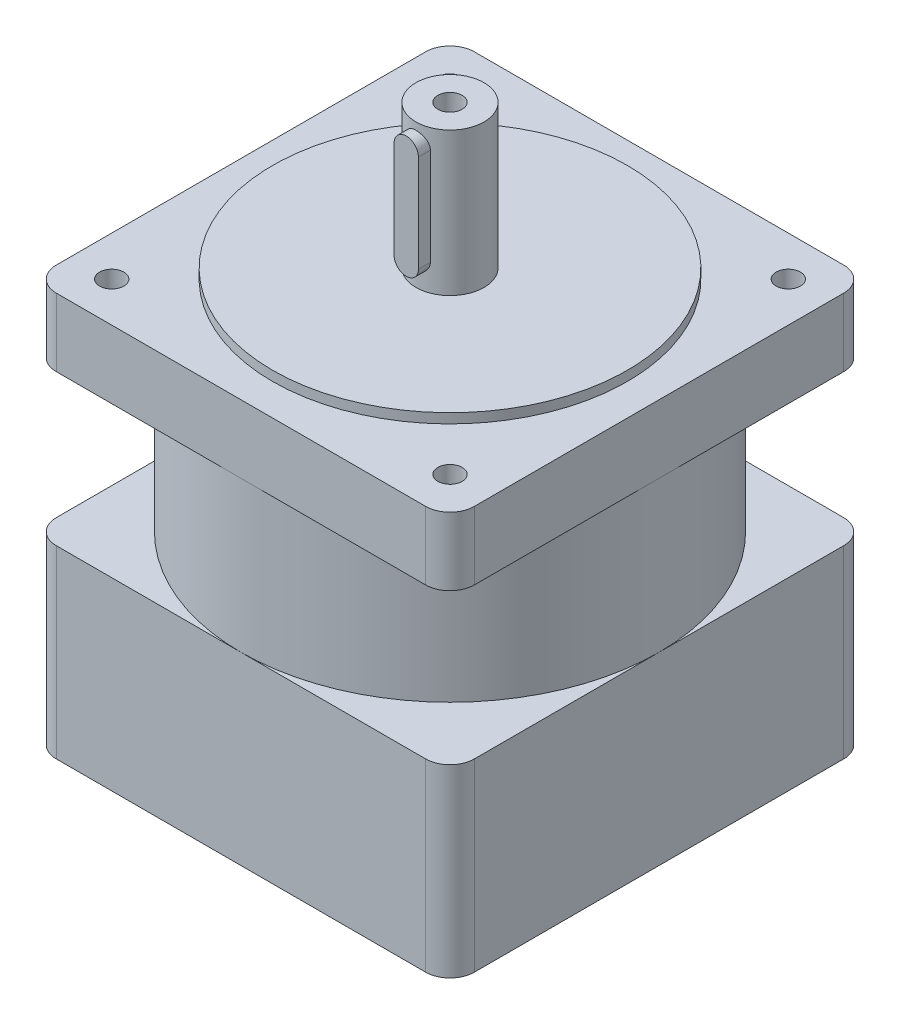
SolidWorks part; units mm, degrees
ref_plane "前视" through (0, 0, 0) normal (0, 0, 1) x (1, 0, 0)
ref_plane "上视" through (0, 0, 0) normal (0, 1, 0) x (1, 0, 0)
ref_plane "右视" through (0, 0, 0) normal (1, 0, 0) x (0, 0, -1)
sketch "草图1" plane through (0, 0, 0) normal (0, 1, 0) x (1, 0, 0)
  line L1 (-43, 43) -> (43, 43)
  line L2 (-43, 43) -> (-43, -43)
  line L3 (-43, -43) -> (43, -43)
  line L4 (43, 43) -> (43, -43)
  line L5 (-43, 43) -> (43, -43) construction
  line L6 (-43, -43) -> (43, 43) construction
  point P0 (0, 0)
extrude "凸台-拉伸1" add sketch "草图1" along normal blind 14
fillet "圆角1" radius 5 4 edges at (-43, 7, -43) (43, 7, -43) (43, 7, 43) (-43, 7, 43)
ref_plane "基准面1" through (0, 14, 0) normal (0, 1, 0) x (1, 0, 0)
sketch "草图2" plane through (0, 14, 0) normal (0, 1, 0) x (1, 0, 0)
  circle A0 centre (0, 0) radius 36.5
  dimension "D1" = 73
extrude "凸台-拉伸2" add sketch "草图2" along normal blind 2
sketch "草图3" plane through (0, 14, 0) normal (0, 1, 0) x (1, 0, 0)
  circle A0 centre (0, 0) radius 7
  dimension "D1" = 14
extrude "凸台-拉伸3" add sketch "草图3" along normal blind 31.5
ref_plane "基准面2" through (0, 0, 4) normal (0, 0, 1) x (1, 0, 0)
sketch "草图4" plane through (0, 0, 4) normal (0, 0, 1) x (1, 0, 0)
  line L2 (-2.5, 41.5) -> (-2.5, 21.5)
  line L4 (2.5, 41.5) -> (2.5, 21.5)
  arc A0 (-2.5, 41.5) -> (2.5, 41.5) centre (0, 41.5) cw
  arc A1 (-2.5, 21.5) -> (2.5, 21.5) centre (0, 21.5) ccw
  dimension "D1" = 2.5
  dimension "D2" = 2.5
extrude "凸台-拉伸4" add sketch "草图4" along normal blind 5
ref_plane "基准面3" through (0, 45.5, 0) normal (0, 1, 0) x (1, 0, 0)
hole_wizard "M6 螺纹孔1" positions "草图6" profile "草图5" tap size "M6" standard "ISO"
sketch "草图6" plane through (0, 45.5, 0) normal (0, 1, 0) x (1, 0, 0)
  point P0 (0, 0)
sketch "草图5" plane through (0, 45.5, 0) normal (1, 0, 0) x (0, 0, 1)
  line L0 (0, 0) -> (0, 18.5022)
  line L1 (0, 18.5022) -> (2.5, 17)
  line L2 (2.5, 17) -> (2.5, 0)
  line L5 (2.5, 0) -> (0, 0)
  line L10 (0, 18.5022) -> (-2.5, 17) construction
  line L11 (0, -6.35) -> (0, 107.95) construction
  dimension "螺纹孔钻头直径" = 5
  dimension "螺纹孔钻头深度" = 17
  dimension "导头角度" = 118
sketch "草图7" plane through (0, 0, 0) normal (0, 1, 0) x (1, 0, 0)
  circle A0 centre (0, 0) radius 43
  dimension "D1" = 86
extrude "凸台-拉伸5" add sketch "草图7" against normal blind 31
ref_plane "基准面4" through (0, -31, 0) normal (0, -1, 0) x (-1, 0, 0)
sketch "草图8" plane through (0, -31, 0) normal (0, -1, 0) x (-1, 0, 0)
  line L1 (43, -43) -> (-43, -43)
  line L2 (43, -43) -> (43, 43)
  line L3 (43, 43) -> (-43, 43)
  line L4 (-43, -43) -> (-43, 43)
  line L5 (43, -43) -> (-43, 43) construction
  line L6 (43, 43) -> (-43, -43) construction
  point P0 (0, 0)
extrude "凸台-拉伸6" add sketch "草图8" along normal blind 38
fillet "圆角2" radius 5 4 edges at (-43, -50, -43) (43, -50, -43) (43, -50, 43) (-43, -50, 43)
ref_plane "基准面5" through (0, -69, 0) normal (0, -1, 0) x (-1, 0, 0)
sketch "草图9" plane through (0, -69, 0) normal (0, -1, 0) x (-1, 0, 0)
  circle A0 centre (0, 0) radius 36.5
  dimension "D1" = 73
extrude "切除-拉伸1" cut sketch "草图9" against normal blind 5
sketch "草图10" plane through (0, -69, 0) normal (0, -1, 0) x (-1, 0, 0)
  line L0 (2.5, -9) -> (2.5, -6.5383)
  line L2 (-2.5, -9) -> (2.5, -9)
  line L3 (-2.5, -9) -> (-2.5, -6.5383)
  arc A0 (-2.5, -6.5383) -> (2.5, -6.5383) centre (0, 0) cw
  dimension "D1" = 7
extrude "切除-拉伸3" cut sketch "草图10" against normal blind 34
sketch "草图11" plane through (0, -69, 0) normal (0, -1, 0) x (-1, 0, 0)
  line L1 (34.8, -34.8) -> (-34.8, -34.8)
  line L2 (34.8, -34.8) -> (34.8, 34.8)
  line L3 (34.8, 34.8) -> (-34.8, 34.8)
  line L4 (-34.8, -34.8) -> (-34.8, 34.8)
  line L5 (34.8, -34.8) -> (-34.8, 34.8) construction
  line L6 (34.8, 34.8) -> (-34.8, -34.8) construction
  point P0 (0, 0)
hole_wizard "M6 螺纹孔2" positions "草图13" profile "草图12" tap size "M6" standard "ISO"
sketch "草图13" plane through (0, -69, 0) normal (0, -1, 0) x (-1, 0, 0)
  point P0 (34.8, -34.8)
  point P3 (34.8, 34.8)
  point P6 (-34.8, 34.8)
  point P9 (-34.8, -34.8)
sketch "草图12" plane through (-34.8, -69, 34.8) normal (1, 0, 0) x (0, 0, -1)
  line L0 (0, 0) -> (0, 18.5022)
  line L1 (0, 18.5022) -> (2.5, 17)
  line L2 (2.5, 17) -> (2.5, 0)
  line L5 (2.5, 0) -> (0, 0)
  line L10 (0, 18.5022) -> (-2.5, 17) construction
  line L11 (0, -6.35) -> (0, 107.95) construction
  dimension "螺纹孔钻头直径" = 5
  dimension "螺纹孔钻头深度" = 17
  dimension "导头角度" = 118
hole_wizard "M6 螺纹孔3" positions "草图16" profile "草图15" tap size "M6" standard "ISO"
sketch "草图16" plane through (0, 14, 0) normal (0, 1, 0) x (1, 0, 0)
  point P0 (-34.8, 34.8)
  point P3 (-34.8, -34.8)
  point P6 (34.8, -34.8)
  point P9 (34.8, 34.8)
sketch "草图15" plane through (-34.8, 14, -34.8) normal (1, 0, 0) x (0, 0, 1)
  line L0 (0, 0) -> (0, 20.5022)
  line L1 (0, 20.5022) -> (2.5, 19)
  line L2 (2.5, 19) -> (2.5, 0)
  line L5 (2.5, 0) -> (0, 0)
  line L10 (0, 20.5022) -> (-2.5, 19) construction
  line L11 (0, -6.35) -> (0, 107.95) construction
  dimension "螺纹孔钻头直径" = 5
  dimension "螺纹孔钻头深度" = 19
  dimension "导头角度" = 118
